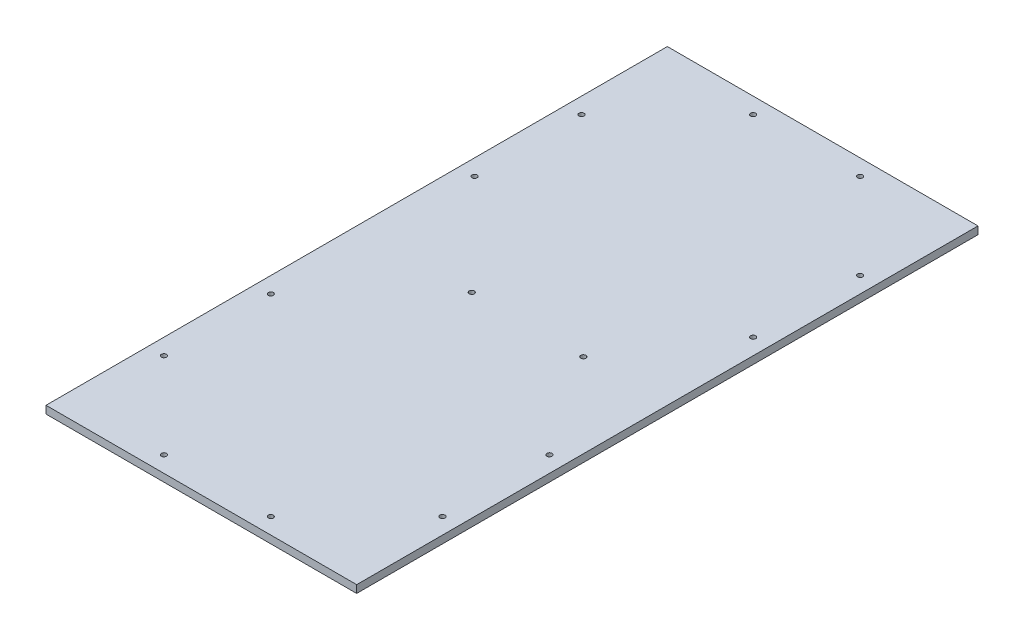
SolidWorks part; units mm, degrees
ref_plane "Front Plane" through (0, 0, 0) normal (0, 0, 1) x (1, 0, 0)
ref_plane "Top Plane" through (0, 0, 0) normal (0, 1, 0) x (1, 0, 0)
ref_plane "Right Plane" through (0, 0, 0) normal (1, 0, 0) x (0, 0, -1)
sketch "Sketch1" plane through (0, 0, 0) normal (0, 1, 0) x (1, 0, 0)
  line L1 (0, 0) -> (610, 0)
  line L2 (0, 0) -> (0, 1220)
  line L3 (0, 1220) -> (610, 1220)
  line L4 (610, 0) -> (610, 1220)
  dimension "D1" = 1220
  dimension "D2" = 610
extrude "Boss-Extrude1" add sketch "Sketch1" along normal blind 15
sketch "Sketch2" plane through (0, 15, 0) normal (0, 1, 0) x (1, 0, 0)
  circle A1 centre (578.5, 200) radius 5
  circle A2 centre (578.5, 200) radius 5
  circle A3 centre (200, 31.5) radius 5
  circle A4 centre (200, 31.5) radius 5
  circle A5 centre (410, 31.5) radius 5
  circle A6 centre (410, 31.5) radius 5
  circle A7 centre (31.5, 200) radius 5
  circle A8 centre (31.5, 200) radius 5
  circle A9 centre (31.5, 410) radius 5
  circle A10 centre (31.5, 410) radius 5
  circle A11 centre (31.5, 810) radius 5
  circle A12 centre (31.5, 810) radius 5
  circle A13 centre (31.5, 1020) radius 5
  circle A14 centre (31.5, 1020) radius 5
  circle A15 centre (200, 1188.5) radius 5
  circle A16 centre (200, 1188.5) radius 5
  circle A17 centre (410, 1188.5) radius 5
  circle A18 centre (410, 1188.5) radius 5
  circle A19 centre (578.5, 1020) radius 5
  circle A20 centre (578.5, 1020) radius 5
  circle A21 centre (578.5, 810) radius 5
  circle A22 centre (578.5, 810) radius 5
  circle A23 centre (578.5, 410) radius 5
  circle A24 centre (578.5, 410) radius 5
  circle A415 centre (226, 610) radius 5 construction
  circle A416 centre (445, 610) radius 5 construction
  circle A417 centre (226, 610) radius 5
  circle A418 centre (445, 610) radius 5
  dimension "D1" = 0
  dimension "D2" = 0
  dimension "D3" = 0
  dimension "D4" = 0
  dimension "D5" = 0
  dimension "D6" = 0
  dimension "D7" = 0
  dimension "D8" = 0
  dimension "D9" = 0
  dimension "D10" = 0
  dimension "D11" = 0
  dimension "D12" = 0
extrude "Cut-Extrude1" cut sketch "Sketch2" against normal up to next
